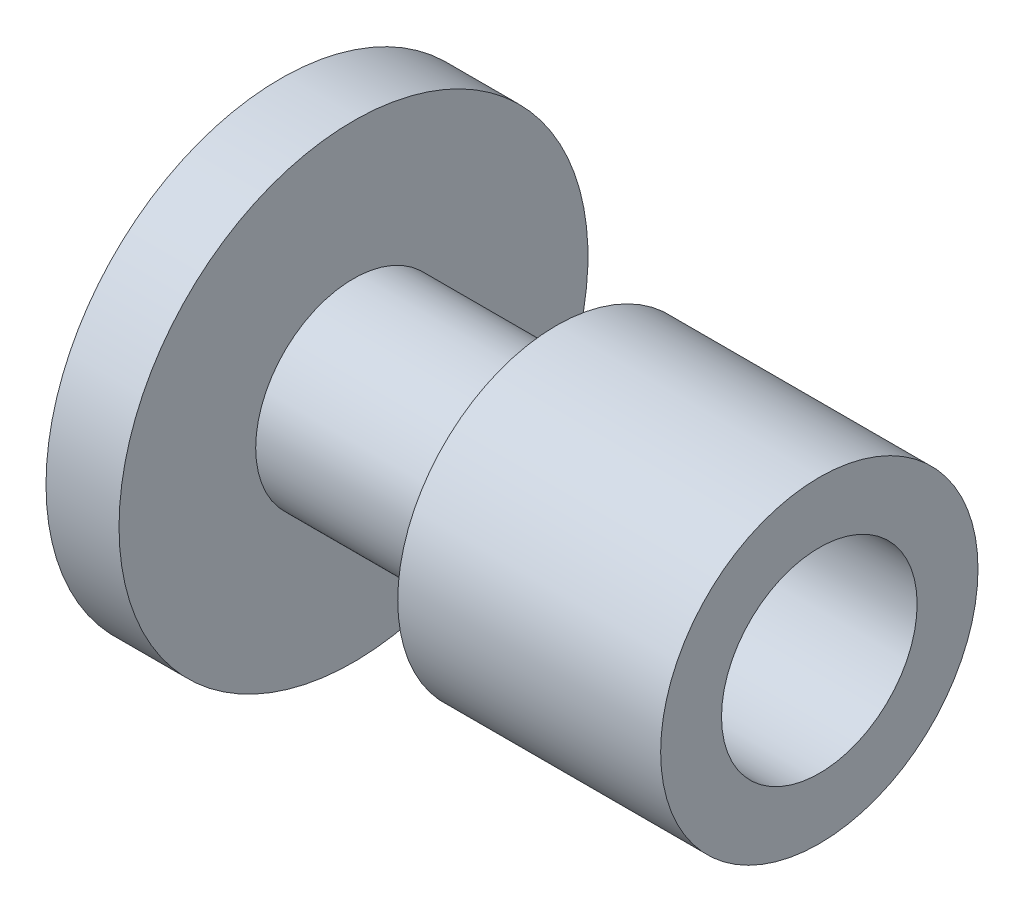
SolidWorks part; units mm, degrees
ref_plane "Front Plane" through (0, 0, 0) normal (0, 0, 1) x (1, 0, 0)
ref_plane "Top Plane" through (0, 0, 0) normal (0, 1, 0) x (1, 0, 0)
ref_plane "Right Plane" through (0, 0, 0) normal (1, 0, 0) x (0, 0, -1)
sketch "Sketch1" plane through (0, 0, 0) normal (0, 0, 1) x (1, 0, 0)
  line L0 (0, 0) -> (0, 30.353)
  line L1 (0, 30.353) -> (9.4534, 30.353)
  line L2 (9.4534, 30.353) -> (9.4534, 12.6632)
  line L3 (69.7561, 12.6632) -> (46.1236, 12.6632)
  line L4 (46.1236, 12.6632) -> (46.1236, 9.5185)
  line L5 (46.1236, 9.5185) -> (7.5475, 9.5185)
  line L7 (9.4534, 12.6632) -> (35.721, 12.6632)
  line L8 (35.721, 12.6632) -> (35.721, 20.5407)
  line L9 (35.721, 20.5407) -> (69.7561, 20.5407)
  line L10 (69.7561, 20.5407) -> (69.7561, 12.6632)
  line L12 (0, 0) -> (65.4851, 0) construction
  line L13 (7.5475, 9.5185) -> (7.5475, 0)
  line L14 (7.5475, 0) -> (0, 0)
revolve "Revolve1" add sketch "Sketch1" angle 360 about L12
